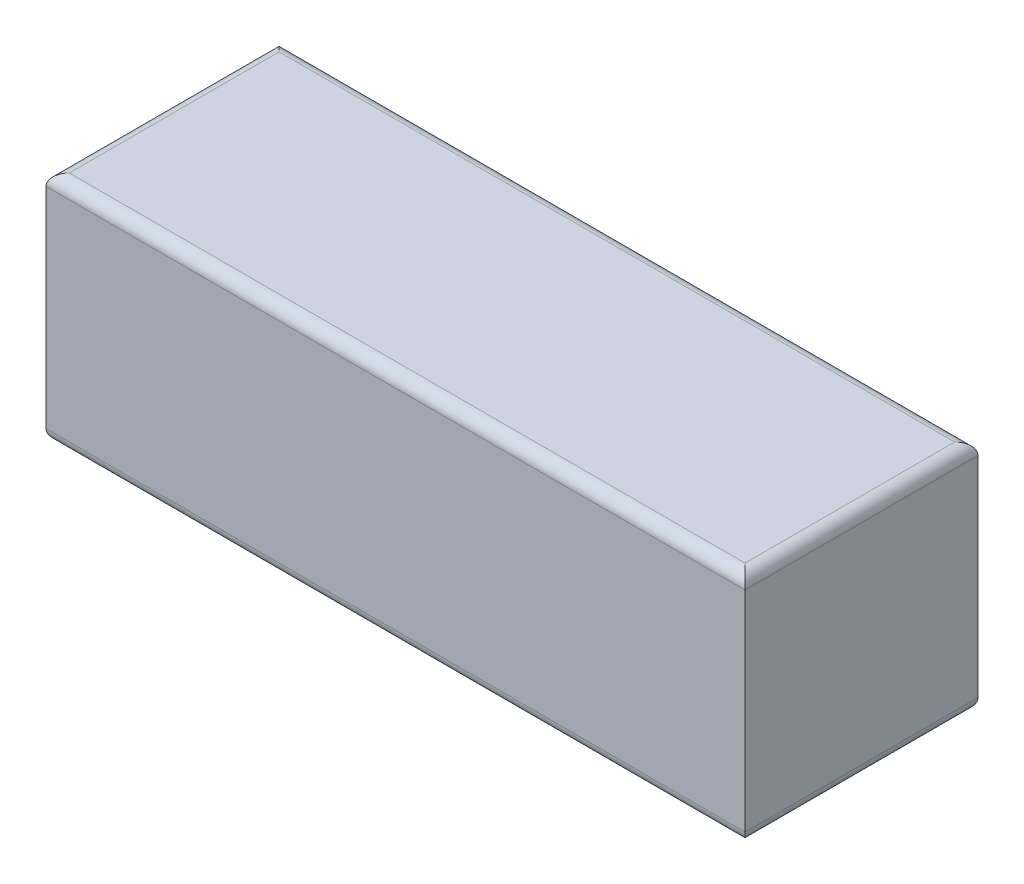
SolidWorks part; units mm, degrees
ref_plane "Front Plane" through (0, 0, 0) normal (0, 0, 1) x (1, 0, 0)
ref_plane "Top Plane" through (0, 0, 0) normal (0, 1, 0) x (1, 0, 0)
ref_plane "Right Plane" through (0, 0, 0) normal (1, 0, 0) x (0, 0, -1)
sketch "Sketch1" plane through (0, 0, 0) normal (0, 1, 0) x (1, 0, 0)
  line L1 (0, 0) -> (60, 0)
  line L2 (0, 0) -> (0, 20)
  line L3 (0, 20) -> (60, 20)
  line L4 (60, 0) -> (60, 20)
extrude "Boss-Extrude1" add sketch "Sketch1" along normal blind 20
fillet "Fillet1" radius 1 8 edges at (30, 0, -20) (0, 0, -10) (60, 0, -10) (30, 0, 0) (30, 20, -20) (60, 20, -10) (30, 20, 0) (0, 20, -10)
